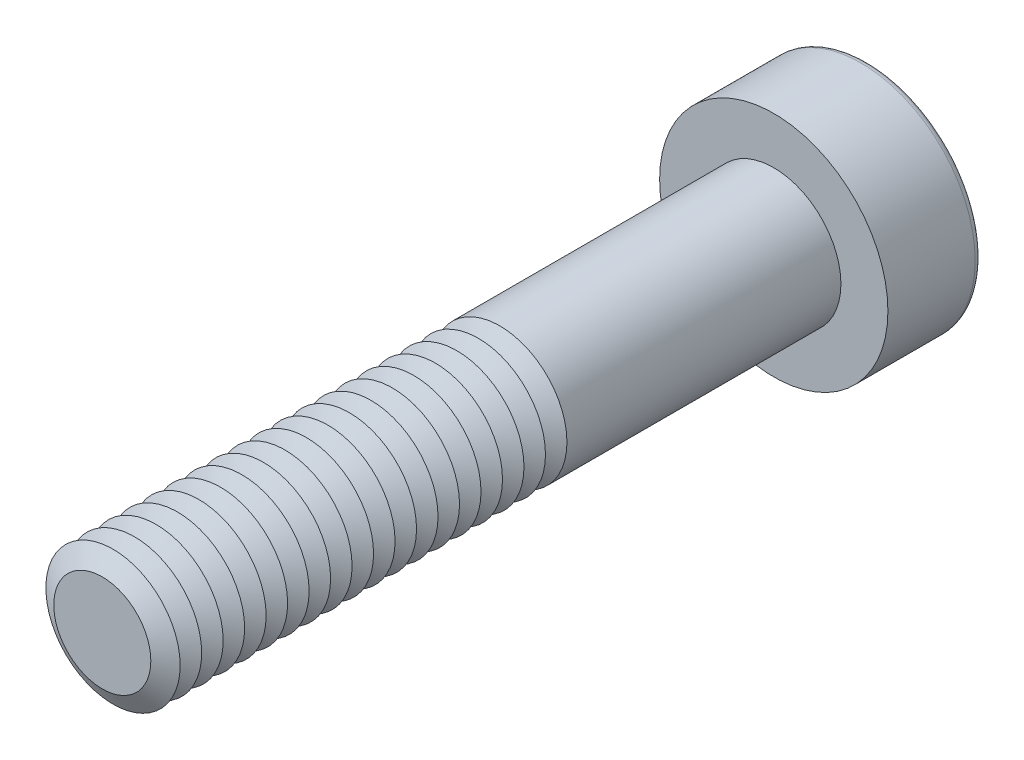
SolidWorks part; units mm, degrees
ref_plane "Front Plane" through (0, 0, 0) normal (0, 0, 1) x (1, 0, 0)
ref_plane "Top Plane" through (0, 0, 0) normal (0, 1, 0) x (1, 0, 0)
ref_plane "Right Plane" through (0, 0, 0) normal (1, 0, 0) x (0, 0, -1)
sketch "Sketch1" plane through (0, 0, 0) normal (0, 0, 1) x (1, 0, 0)
  circle A0 centre (0, 0) radius 2.5
  dimension "D1" = 5
extrude "Boss-Extrude1" add sketch "Sketch1" along normal blind 25
sketch "Sketch2" plane through (0, 0, 0) normal (0, 0, -1) x (-1, 0, 0)
  circle A0 centre (0, 0) radius 4.25
  dimension "D1" = 8.5
extrude "Boss-Extrude2" add sketch "Sketch2" along normal blind 3.5
sketch "Sketch3" plane through (0, 0, -3.5) normal (0, 0, -1) x (-1, 0, 0)
  line L1 (-0.866, 1.5) -> (-1.7321, 0)
  line L2 (-1.7321, 0) -> (-0.866, -1.5)
  line L3 (-0.866, -1.5) -> (0.866, -1.5)
  line L4 (0.866, -1.5) -> (1.7321, 0)
  line L5 (1.7321, 0) -> (0.866, 1.5)
  line L6 (0.866, 1.5) -> (-0.866, 1.5)
  circle A0 centre (0, 0) radius 1.5 construction
  dimension "D1" = 3
extrude "Cut-Extrude1" cut sketch "Sketch3" against normal blind 2.25
fillet "Fillet1" radius 0.25 1 edges at (-4.25, 0, -3.5)
sketch "Sketch4" plane through (0, 0, -1.25) normal (0, 0, -1) x (-1, 0, 0)
  line L0 (0.866, -1.5) -> (1.7321, 0) construction
  circle A0 centre (0, 0) radius 1.5
extrude "Cut-Extrude2" cut sketch "Sketch4" against normal through all draft 60
sketch "Sketch5" plane through (0, 0, -3.5) normal (0, 0, -1) x (-1, 0, 0)
  circle A0 centre (0, 0) radius 1.7321
extrude "Cut-Extrude3" cut sketch "Sketch5" against normal through all draft 75
sketch "Sketch7" plane through (0, 0, 0) normal (1, 0, 0) x (0, 0, -1)
  line L25 (-25, 1.8072) -> (-24.6, 2.5)
  line L26 (-25, 2.5) -> (-25, -2.5) construction
  line L27 (-24.6, 2.5) -> (-25.4, 2.5)
  line L28 (-25.4, 2.5) -> (-25, 1.8072)
  line L29 (0, 2.5) -> (-25, 2.5) construction
  dimension "D1" = 0.8
revolve "Cut-Revolve1" cut sketch "Sketch7" angle 360 about axis through (0, 0, 25) along (0, 0, -1)
pattern_linear "LPattern1" count 19 spacing 0.8 along (0, 0, -1) of "Cut-Revolve1"
